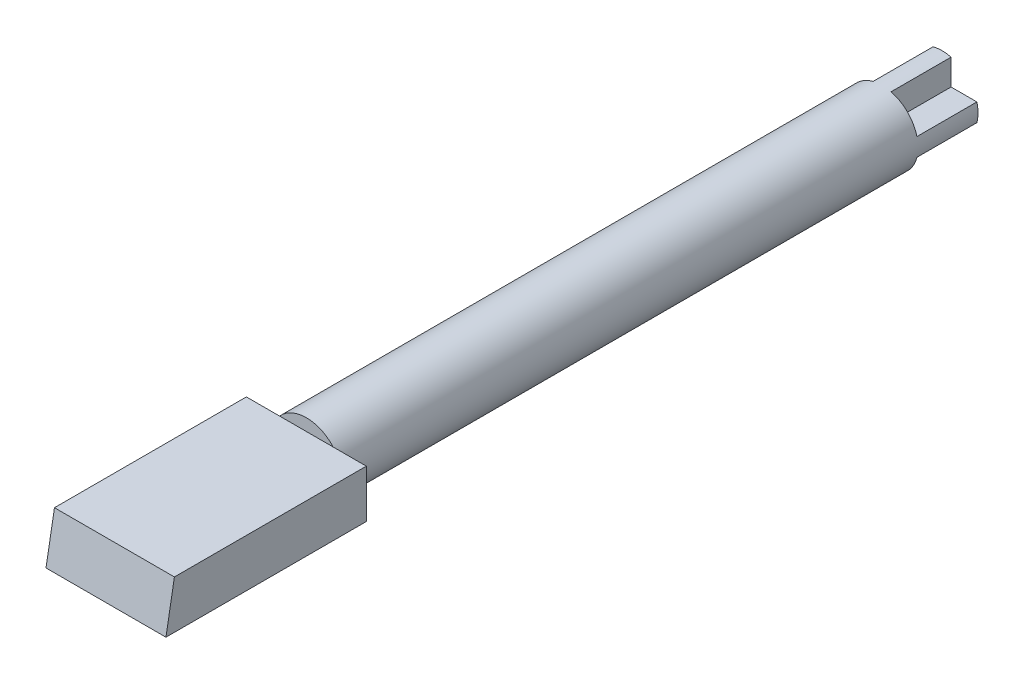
SolidWorks part; units mm, degrees
ref_plane "前视基准面" through (0, 0, 0) normal (0, 0, 1) x (1, 0, 0)
ref_plane "上视基准面" through (0, 0, 0) normal (0, 1, 0) x (1, 0, 0)
ref_plane "右视基准面" through (0, 0, 0) normal (1, 0, 0) x (0, 0, -1)
sketch "草图1" plane through (0, 0, 0) normal (0, 0, 1) x (1, 0, 0)
  circle A0 centre (0, 0) radius 3
  dimension "D1" = 6
extrude "凸台-拉伸1" add sketch "草图1" along normal blind 48
sketch "草图2" plane through (0, 0, 0) normal (1, 0, 0) x (0, 0, -1)
  line L0 (-48, 2) -> (-64, 2)
  line L1 (-48, 3) -> (-48, -3) construction
  line L2 (-64, 2) -> (-64.7053, -2)
  line L3 (-64.7053, -2) -> (-48, -2)
  line L4 (-48, -2) -> (-48, 2)
  line L5 (-48, 0) -> (0, 0) construction
  dimension "D1" = 4
  dimension "D2" = 80
  dimension "D3" = 16
extrude "凸台-拉伸2" add sketch "草图2" along normal mid plane 10
sketch "草图3" plane through (0, 0, 0) normal (0, 0, -1) x (-1, 0, 0)
  line L1 (0.75, 2.9047) -> (-0.75, 2.9047)
  line L2 (0.75, 2.9047) -> (0.75, -2.9047)
  line L3 (0.75, -2.9047) -> (-0.75, -2.9047)
  line L4 (-0.75, 2.9047) -> (-0.75, -2.9047)
  line L5 (0.75, 2.9047) -> (-0.75, -2.9047) construction
  line L6 (0.75, -2.9047) -> (-0.75, 2.9047) construction
  line L7 (2.9047, 0.75) -> (-2.9047, 0.75)
  line L8 (2.9047, 0.75) -> (2.9047, -0.75)
  line L9 (2.9047, -0.75) -> (-2.9047, -0.75)
  line L10 (-2.9047, 0.75) -> (-2.9047, -0.75)
  line L11 (2.9047, 0.75) -> (-2.9047, -0.75) construction
  line L12 (2.9047, -0.75) -> (-2.9047, 0.75) construction
  circle A1 centre (0, 0) radius 3
  circle A2 centre (0, 0) radius 3
  dimension "D2" = 1.5
  dimension "D3" = 1.5
  dimension "D1" = 0
extrude "凸台-拉伸4" add sketch "草图3" along normal blind 5 contours L9 L8 L7 L2 | L8 M6 | L9 L2 L7 L4 | L7 L2 L1 L4 | L7 L10 L9 L4 | L2 L9 L4 L3 | L10 M6 | L1 M6 | L3 M6
